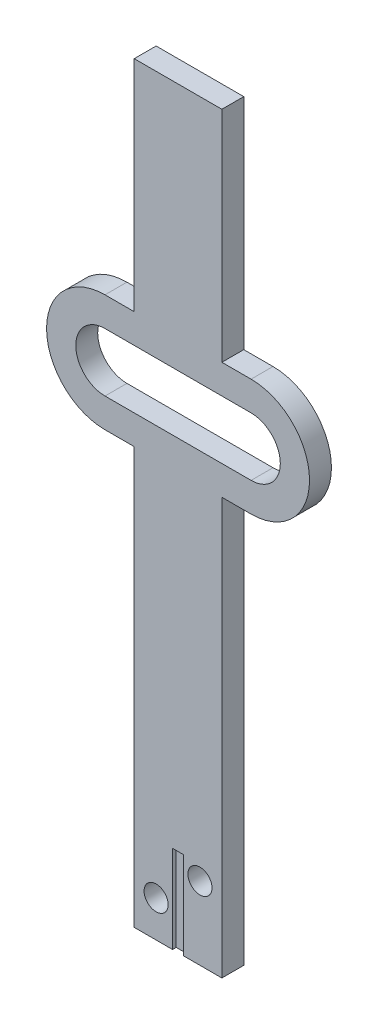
SolidWorks part; units mm, degrees
ref_plane "Plan1" through (0, 0, 0) normal (0, 0, 1) x (1, 0, 0)
ref_plane "Plan2" through (0, 0, 0) normal (0, 1, 0) x (1, 0, 0)
ref_plane "Plan3" through (0, 0, 0) normal (1, 0, 0) x (0, 0, -1)
sketch "Esquisse1" plane through (0, 0, 0) normal (0, 0, 1) x (1, 0, 0)
  line L0 (-10, 0) -> (10, 0) construction
  line L1 (-10, 8) -> (-6, 8)
  line L2 (-10, -8) -> (-6, -8)
  line L3 (0, 38) -> (0, -65) construction
  line L4 (-6, 38) -> (6, 38)
  line L5 (-6, 38) -> (-6, 8)
  line L6 (-6, -65) -> (6, -65)
  line L7 (6, 38) -> (6, 8)
  line L8 (-6, -8) -> (-6, -65)
  line L9 (6, -8) -> (10, -8)
  line L10 (6, -8) -> (6, -65)
  line L11 (6, 8) -> (10, 8)
  line L12 (-10, 4) -> (10, 4)
  line L13 (10, -4) -> (-10, -4)
  arc A0 (10, -8) -> (10, 8) centre (10, 0) ccw
  arc A1 (-10, 8) -> (-10, -8) centre (-10, 0) ccw
  arc A2 (-10, 4) -> (-10, -4) centre (-10, 0) ccw
  arc A3 (10, -4) -> (10, 4) centre (10, 0) ccw
  dimension "D1" = 16
  dimension "D6" = 8
  dimension "D2" = 20
  dimension "D3" = 12
  dimension "D4" = 103
  dimension "D5" = 30
extrude "Base-Extrusion" add sketch "Esquisse1" along normal blind 3
sketch "Esquisse2" plane through (0, 0, 3) normal (0, 0, 1) x (1, 0, 0)
  line L0 (-6, -65) -> (6, -65) construction
  line L1 (-0.75, -53) -> (0.75, -53)
  line L2 (-0.75, -53) -> (-0.75, -65)
  line L3 (-0.75, -65) -> (0.75, -65)
  line L4 (0.75, -53) -> (0.75, -65)
  line L5 (0.75, -59) -> (6, -59) construction
  line L6 (6, -65) -> (6, -8) construction
  line L7 (-0.75, -59) -> (-6, -59) construction
  line L8 (-6, -8) -> (-6, -65) construction
  dimension "D1" = 1.5
  dimension "D2" = 12
extrude "Enlèv. mat.-Extru.1" cut sketch "Esquisse2" against normal blind 0.5
hole_wizard "Perçage1" positions "Esquisse4" profile "Esquisse3" tap size "M4x0.7" standard "ISO"
sketch "Esquisse4" plane through (0, 0, 3) normal (0, 0, 1) x (1, 0, 0)
  line L0 (6, -65) -> (6, -8) construction
  line L1 (0.75, -65) -> (6, -65) construction
  point P0 (3, -55)
  dimension "D1" = 3
  dimension "D2" = 10
sketch "Esquisse3" plane through (3, -55, 3) normal (1, 0, 0) x (0, -1, 0)
  line L0 (0, 0) -> (0, 3)
  line L1 (0, 3) -> (1.65, 3)
  line L2 (1.65, 3) -> (1.65, 0)
  line L5 (1.65, 0) -> (0, 0)
  line L11 (0, -6.35) -> (0, 107.95) construction
  dimension "Diamètre du perçage jusqu'au prochain" = 3.3
  dimension "Profondeur du perçage jusqu'au prochain" = 3
hole_wizard "Perçage2" positions "Esquisse6" profile "Esquisse5" tap size "M4x0.7" standard "ISO"
sketch "Esquisse6" plane through (0, 0, 3) normal (0, 0, 1) x (1, 0, 0)
  line L0 (-6, -8) -> (-6, -65) construction
  line L1 (-6, -65) -> (-0.75, -65) construction
  point P0 (-3, -60)
  dimension "D1" = 3
  dimension "D2" = 5
sketch "Esquisse5" plane through (-3, -60, 3) normal (1, 0, 0) x (0, -1, 0)
  line L0 (0, 0) -> (0, 3)
  line L1 (0, 3) -> (1.65, 3)
  line L2 (1.65, 3) -> (1.65, 0)
  line L5 (1.65, 0) -> (0, 0)
  line L11 (0, -6.35) -> (0, 107.95) construction
  dimension "Diamètre du perçage jusqu'au prochain" = 3.3
  dimension "Profondeur du perçage jusqu'au prochain" = 3
